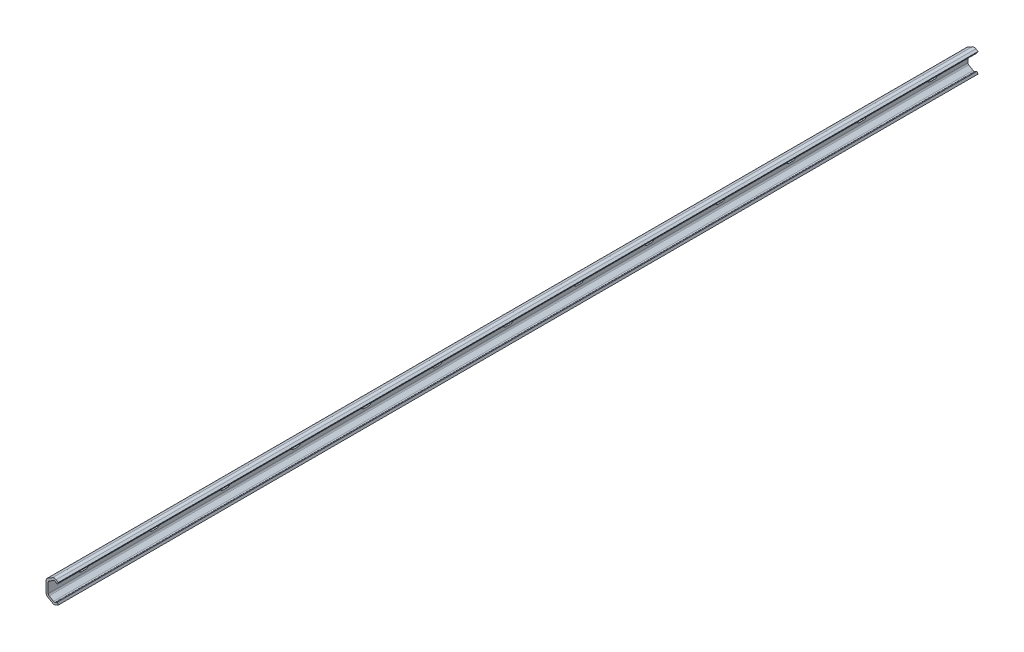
SolidWorks part; units mm, degrees
ref_plane "Front Plane" through (0, 0, 0) normal (0, 0, 1) x (1, 0, 0)
ref_plane "Top Plane" through (0, 0, 0) normal (0, 1, 0) x (1, 0, 0)
ref_plane "Right Plane" through (0, 0, 0) normal (1, 0, 0) x (0, 0, -1)
sketch "Sketch1" plane through (0, 0, 0) normal (0, 0, 1) x (1, 0, 0)
  line L0 (12.7499, 8.8877) -> (14, 11.0528)
  line L1 (14, 11.0528) -> (11.5, 12.4962)
  line L2 (7.4998, 12.4962) -> (1.9999, 9.3207)
  line L3 (0, 5.8567) -> (0, -5.8567)
  line L4 (1.9999, -9.3207) -> (7.4998, -12.4962)
  line L5 (11.5, -12.4962) -> (14, -11.0528)
  line L6 (14, -11.0528) -> (12.7499, -8.8877)
  line L7 (12.7499, -8.8877) -> (10.4999, -10.1867)
  line L8 (8.4998, -10.1867) -> (3.5001, -7.3)
  line L10 (2.5002, -5.568) -> (2.5002, 0)
  line L11 (2.5002, 0) -> (2.5002, 5.568)
  line L12 (3.5001, 7.3) -> (8.4998, 10.1867)
  line L13 (10.4999, 10.1867) -> (12.7499, 8.8877)
  arc A0 (11.5, 12.4962) -> (7.4998, 12.4962) centre (9.4999, 9.032) ccw
  arc A1 (1.9999, 9.3207) -> (0, 5.8567) centre (4, 5.8567) ccw
  arc A2 (0, -5.8567) -> (1.9999, -9.3207) centre (4, -5.8567) ccw
  arc A3 (7.4998, -12.4962) -> (11.5, -12.4962) centre (9.4999, -9.032) ccw
  arc A4 (10.4999, -10.1867) -> (8.4998, -10.1867) centre (9.4999, -8.4547) cw
  arc A6 (2.5002, 5.568) -> (3.5001, 7.3) centre (4.5002, 5.568) cw
  arc A7 (8.4998, 10.1867) -> (10.4999, 10.1867) centre (9.4999, 8.4547) cw
  arc A8 (2.5002, -5.568) -> (3.5001, -7.3) centre (4.5002, -5.568) ccw
  point P50 (0, 0)
  dimension "D1" = 4.0001
  dimension "D2" = 4
  dimension "D3" = 1.9999
  dimension "D4" = 2
  dimension "D5" = 2.5002
  dimension "D6" = 7.4998
  dimension "D7" = 12.7499
  dimension "D8" = 14
  dimension "D9" = 5.568
extrude "Boss-Extrude1" add sketch "Sketch1" against normal blind 1040 contours L11 A6 L12 A7 L13 L0 L1 A0 L2 A1 L3 A2 L4 A3 L5 L6 L7 A4 L8 A8 L10
sketch "Sketch2" plane through (2.5002, 0, 0) normal (1, 0, 0) x (0, 0, -1)
  line L0 (37.5, 0) -> (42.5, 0) construction
  line L1 (37.5, 3) -> (42.5, 3)
  line L2 (37.5, -3) -> (42.5, -3)
  arc A0 (37.5, 3) -> (37.5, -3) centre (37.5, 0) ccw
  arc A1 (42.5, -3) -> (42.5, 3) centre (42.5, 0) ccw
  point P2 (40, 0)
  point P9 (40, 3)
  dimension "D1" = 5
  dimension "D2" = 6
  dimension "D3" = 40
extrude "Cut-Extrude1" cut sketch "Sketch2" against normal through all
pattern_linear "LPattern1" count 13 spacing 80 along (0, 0, -1) of "Cut-Extrude1"
